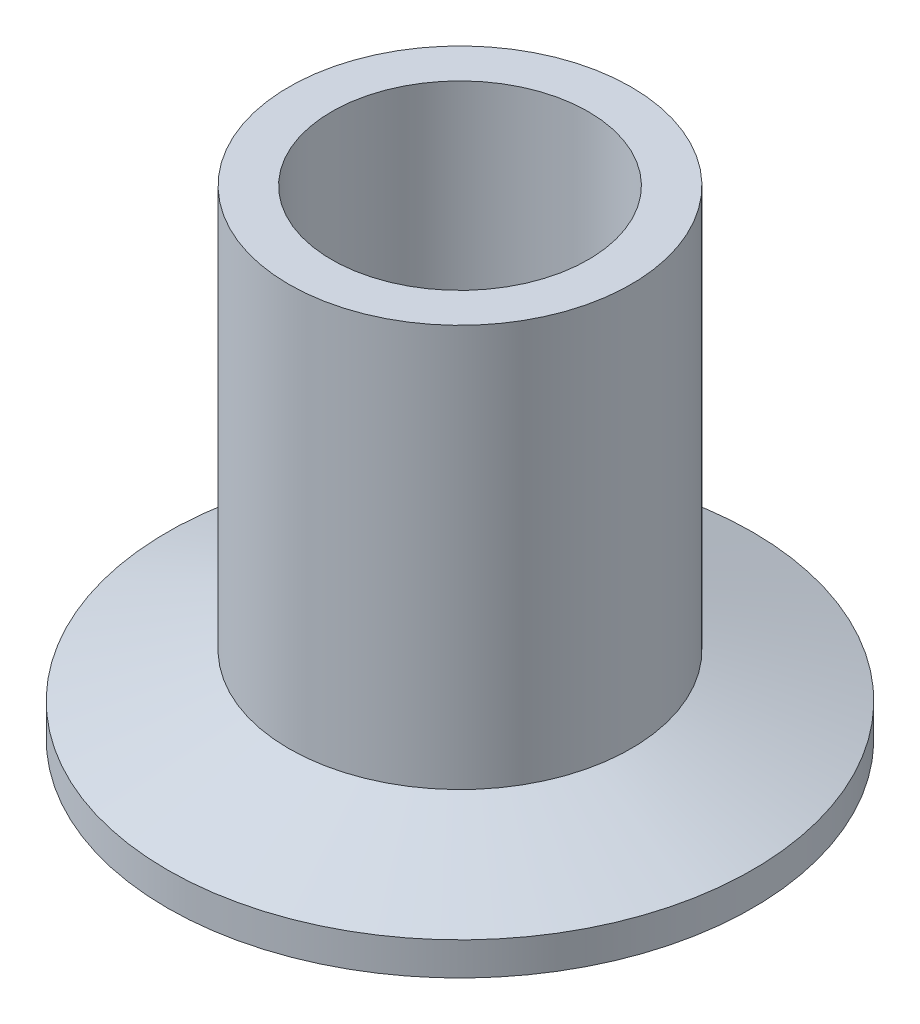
SolidWorks part; units mm, degrees
ref_plane "Front Plane" through (0, 0, 0) normal (0, 0, 1) x (1, 0, 0)
ref_plane "Top Plane" through (0, 0, 0) normal (0, 1, 0) x (1, 0, 0)
ref_plane "Right Plane" through (0, 0, 0) normal (1, 0, 0) x (0, 0, -1)
sketch "Sketch1" plane through (0, 0, 0) normal (0, 0, 1) x (1, 0, 0)
  line L0 (0, 0) -> (0, 41.275) construction
  line L1 (0, 41.275) -> (-14.732, 41.275)
  line L2 (-14.732, 41.275) -> (-14.732, 6.6537)
  line L3 (-14.732, 6.6537) -> (-25.1968, 2.8448)
  line L4 (-25.1968, 2.8448) -> (-25.1968, 0)
  line L5 (-25.1968, 0) -> (-23.6441, 0)
  line L6 (-20.0446, 0) -> (0, 0)
  line L7 (0, 0) -> (0, 41.275)
  line L8 (0, 41.275) -> (-11.049, 41.275)
  line L9 (-11.049, 41.275) -> (-11.049, 0)
  line L10 (-11.049, 0) -> (0, 0)
  line L11 (0, 0) -> (-0.1846, 0.0129)
  line L12 (-14.732, 6.6537) -> (-17.7525, 6.6537) construction
  line L13 (-20.5219, 0.3343) -> (-20.6968, 0.8147)
  line L14 (-22.9634, 0.7448) -> (-23.1876, 0.2853)
  line L15 (-21.8186, 0.4064) -> (-21.8186, -0.8532) construction
  arc A0 (-20.6968, 0.8147) -> (-22.9634, 0.7448) centre (-21.8186, 0.4064) ccw
  arc A1 (-20.0446, 0) -> (-20.5219, 0.3343) centre (-20.0446, 0.508) cw
  arc A2 (-23.6441, 0) -> (-23.1876, 0.2853) centre (-23.6441, 0.508) ccw
  dimension "D6" = 0.4064
  dimension "D7" = 21.8186
  dimension "D5" = 46
  dimension "D10" = 1.1938
  dimension "D11" = 0.508
  dimension "D1" = 14.732
  dimension "D2" = 20
  dimension "D3" = 25.1968
  dimension "D4" = 2.8448
  dimension "D8" = 3.683
  dimension "D9" = 41.275
revolve "Revolve2" add sketch "Sketch1" angle 360 about L0
